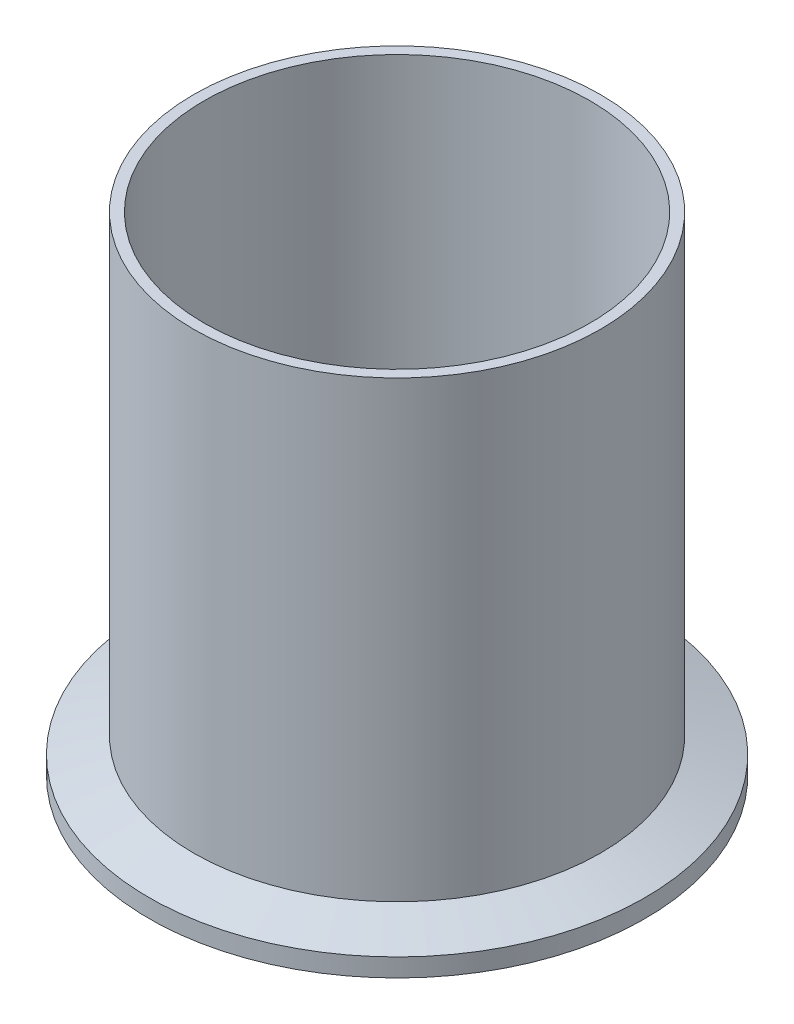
SolidWorks part; units mm, degrees
ref_plane "Front Plane" through (0, 0, 0) normal (0, 0, 1) x (1, 0, 0)
ref_plane "Top Plane" through (0, 0, 0) normal (0, 1, 0) x (1, 0, 0)
ref_plane "Right Plane" through (0, 0, 0) normal (1, 0, 0) x (0, 0, -1)
sketch "Sketch1" plane through (0, 0, 0) normal (0, 0, 1) x (1, 0, 0)
  line L0 (0, 0) -> (0, 76.2) construction
  line L1 (0, 76.2) -> (-31.75, 76.2)
  line L2 (-31.75, 76.2) -> (-31.75, 5.3779)
  line L3 (-31.75, 5.3779) -> (-38.7096, 2.8448)
  line L4 (-38.7096, 2.8448) -> (-38.7096, 0)
  line L5 (-38.7096, 0) -> (-37.1367, 0)
  line L6 (-33.5007, 0) -> (0, 0)
  line L7 (0, 0) -> (0, 76.2)
  line L8 (0, 76.2) -> (-30.099, 76.2)
  line L9 (-30.099, 76.2) -> (-30.099, 0)
  line L10 (-30.099, 0) -> (0, 0)
  line L11 (0, 0) -> (-0.1846, 0.0129)
  arc A0 (-36.4142, 0.4745) -> (-34.2232, 0.4745) centre (-35.3187, 0) cw
  arc A1 (-33.5007, 0) -> (-34.2232, 0.4745) centre (-33.5007, 0.7874) cw
  arc A2 (-36.4142, 0.4745) -> (-37.1367, 0) centre (-37.1367, 0.7874) cw
  point P12 (-34.1249, 0)
  dimension "D6" = 1.1938
  dimension "D7" = 0.7874
  dimension "D1" = 31.75
  dimension "D2" = 2.8448
  dimension "D3" = 38.7096
  dimension "D4" = 70
  dimension "D5" = 35.3187
  dimension "D8" = 1.651
  dimension "D9" = 76.2
revolve "Revolve2" add sketch "Sketch1" angle 360 about L0
